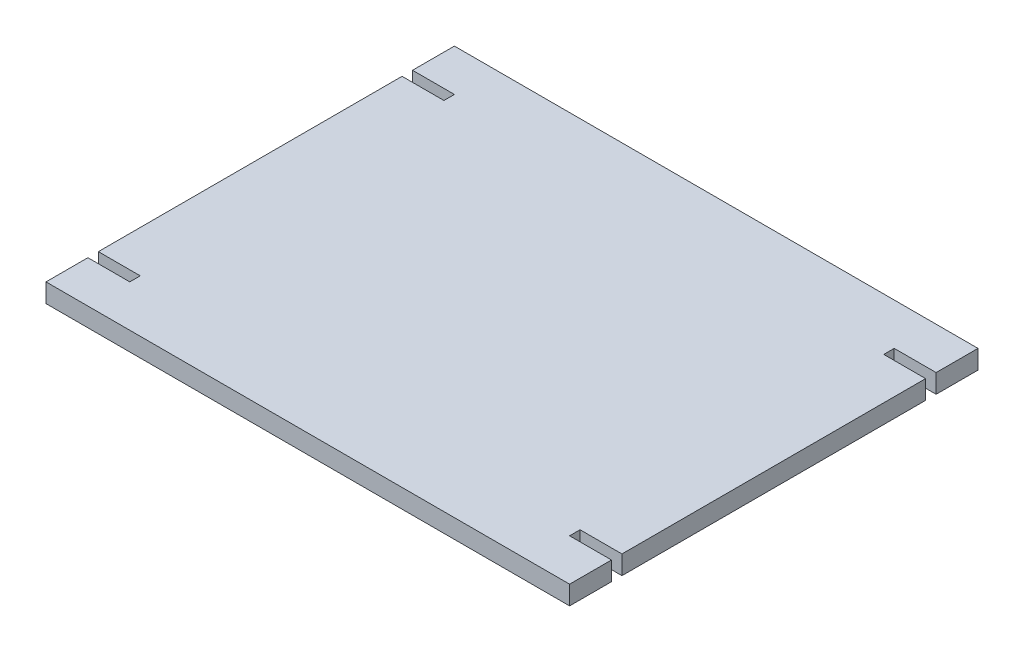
SolidWorks part; units mm, degrees
ref_plane "Front Plane" through (0, 0, 0) normal (0, 0, 1) x (1, 0, 0)
ref_plane "Top Plane" through (0, 0, 0) normal (0, 1, 0) x (1, 0, 0)
ref_plane "Right Plane" through (0, 0, 0) normal (1, 0, 0) x (0, 0, -1)
sketch "Sketch1" plane through (0, 0, 0) normal (0, 1, 0) x (1, 0, 0)
  line L0 (-301.875, 206.1458) -> (198.125, 206.1458)
  line L1 (198.125, 206.1458) -> (198.125, 166.1458)
  line L2 (198.125, 166.1458) -> (158.125, 166.1458)
  line L3 (158.125, 166.1458) -> (158.125, 156.1458)
  line L4 (158.125, 156.1458) -> (198.125, 156.1458)
  line L5 (198.125, 156.1458) -> (198.125, -133.8542)
  line L6 (198.125, -133.8542) -> (158.125, -133.8542)
  line L7 (158.125, -133.8542) -> (158.125, -143.8542)
  line L8 (158.125, -143.8542) -> (198.125, -143.8542)
  line L9 (198.125, -143.8542) -> (198.125, -183.8542)
  line L10 (198.125, -183.8542) -> (-301.875, -183.8542)
  line L11 (-301.875, -183.8542) -> (-301.875, -143.8542)
  line L12 (-301.875, -143.8542) -> (-261.875, -143.8542)
  line L13 (-261.875, -143.8542) -> (-261.875, -133.8542)
  line L14 (-261.875, -133.8542) -> (-301.875, -133.8542)
  line L15 (-301.875, -133.8542) -> (-301.875, 156.1458)
  line L16 (-301.875, 156.1458) -> (-261.875, 156.1458)
  line L17 (-261.875, 156.1458) -> (-261.875, 166.1458)
  line L18 (-261.875, 166.1458) -> (-301.875, 166.1458)
  line L19 (-301.875, 166.1458) -> (-301.875, 206.1458)
  dimension "D1" = 10
  dimension "D2" = 40
  dimension "D3" = 40
  dimension "D4" = 390
  dimension "D5" = 500
extrude "Boss-Extrude1" add sketch "Sketch1" along normal blind 18
